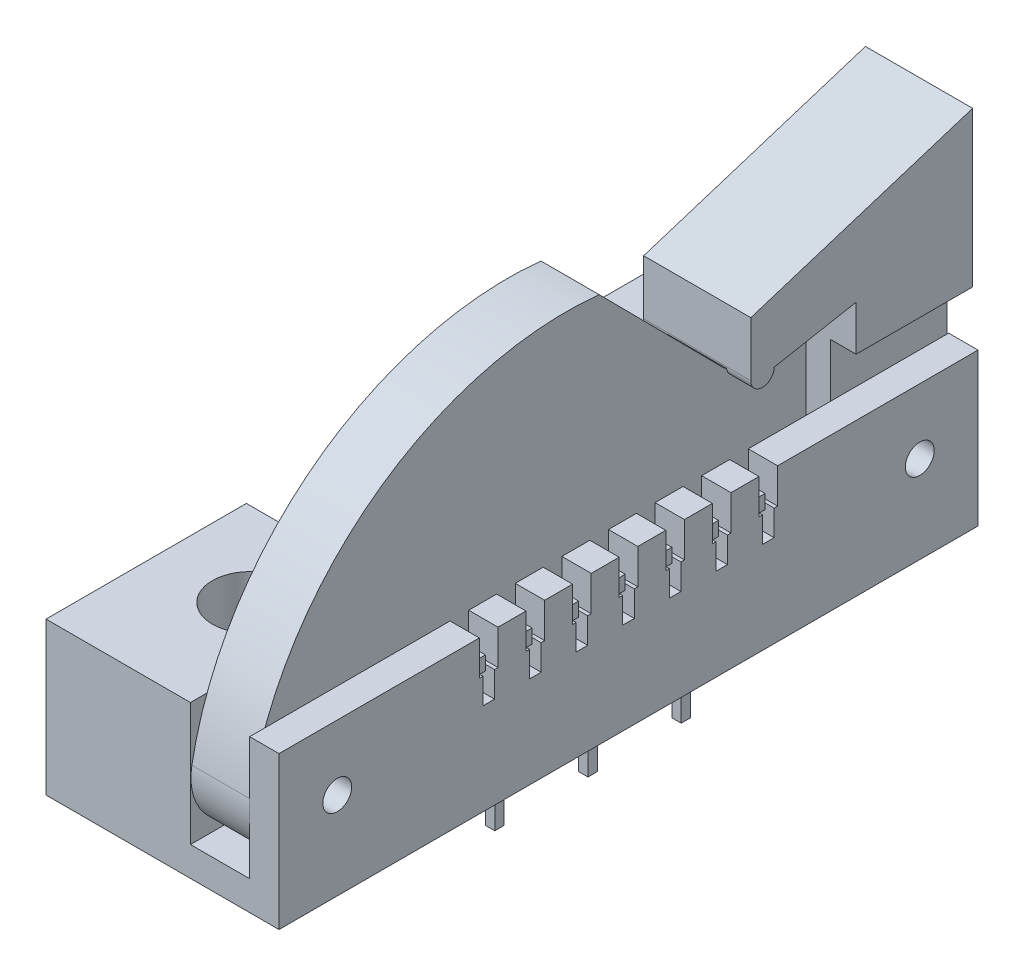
SolidWorks part; units mm, degrees
ref_plane "Front Plane" through (0, 0, 0) normal (0, 0, 1) x (1, 0, 0)
ref_plane "Top Plane" through (0, 0, 0) normal (0, 1, 0) x (1, 0, 0)
ref_plane "Right Plane" through (0, 0, 0) normal (1, 0, 0) x (0, 0, -1)
imported_body "Azimuth 5A Standard, 5250-100W-7S-2-surface1"
imported_body "Azimuth 5A Pin-1-surface1"
imported_body "Azimuth 5A Pin-2-surface1"
imported_body "Azimuth 5A Pin-3-surface1"
imported_body "Azimuth 5A Pin-4-surface1"
imported_body "Azimuth 5A Pin-5-surface1"
imported_body "Azimuth 5A Pin-6-surface1"
imported_body "Azimuth 5A Pin-7-surface1"
imported_body "Azimuth Clip-1-surface1"
imported_body "Azimuth Latch-1-surface1"
move or copy body "Body-Move/Copy1" [suppressed] bodies to move or copy 110 copy no rotation origin (0, -1.5875, -15.875) rotation axis (-1, 0, 0) rotation angle 90
move or copy body "Body-Move/Copy2" [suppressed] bodies to move or copy 109 copy no rotation origin (0, -1.5875, 15.875) rotation axis (1, 0, 0) rotation angle 115
ref_plane "Plane1" through (0, -9.525, 0) normal (0, -1, 0) x (1, 0, 0)
surface "Surface-Trim1"
surface "Surface-Fill1"
surface "Surface-Fill2"
